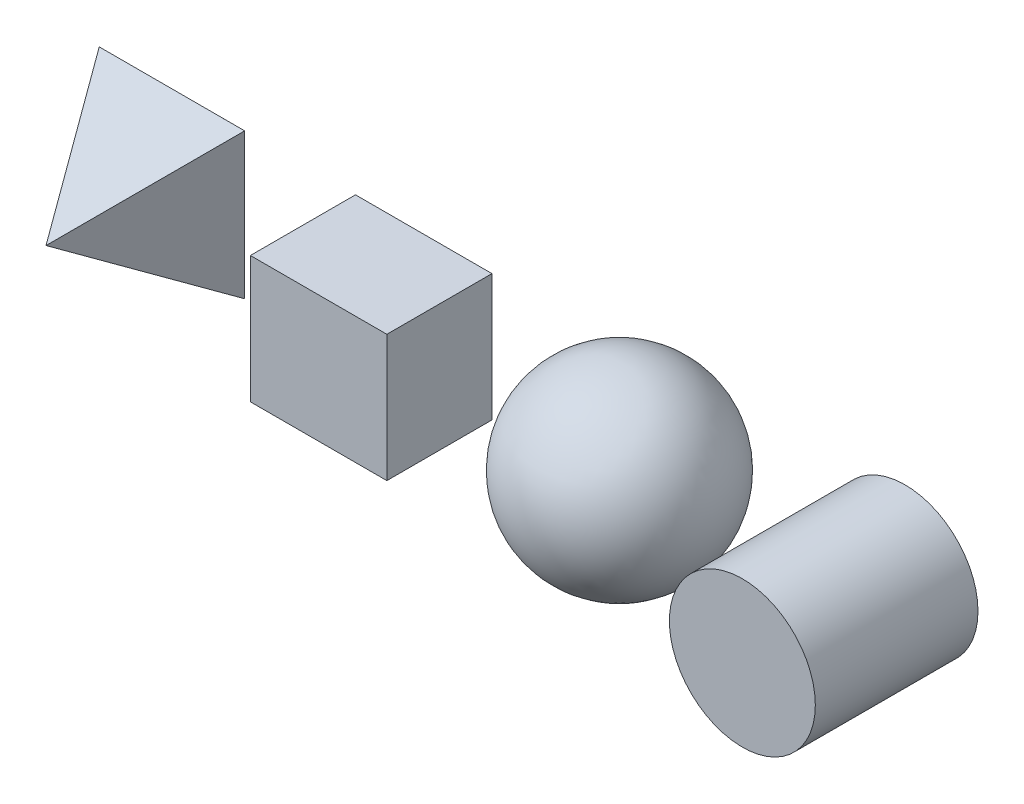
SolidWorks part; units mm, degrees
ref_plane "Front XY" through (0, 0, 0) normal (0, 0, 1) x (1, 0, 0)
ref_plane "Top XZ" through (0, 0, 0) normal (0, 1, 0) x (1, 0, 0)
ref_plane "Right YZ" through (0, 0, 0) normal (1, 0, 0) x (0, 0, -1)
sketch "Sketch1" plane through (0, 0, 0) normal (0, 0, 1) x (1, 0, 0)
  line L1 (0, 0) -> (24.0771, 0)
  line L2 (0, 0) -> (0, -22.364)
  line L3 (0, -22.364) -> (24.0771, -22.364)
  line L4 (24.0771, 0) -> (24.0771, -22.364)
extrude "Extrude1" add sketch "Sketch1" along normal blind 18.542
sketch "Sketch2" plane through (0, 0, 0) normal (0, 0, 1) x (1, 0, 0)
  line L0 (56.3261, 7.5353) -> (56.3261, -25.6979)
  arc A0 (56.3261, 7.5353) -> (56.3261, -25.6979) centre (56.3261, -9.0813) ccw
revolve "Revolve1" add sketch "Sketch2" angle 360 about L0
sketch "Sketch3" plane through (0, 0, 0) normal (0, 0, 1) x (1, 0, 0)
  line L1 (-19.5517, 0) -> (-45.212, 0)
  line L2 (-19.5517, 0) -> (-19.5517, -25.6604)
  line L3 (-19.5517, -25.6604) -> (-45.212, -25.6604)
  line L4 (-45.212, 0) -> (-45.212, -25.6604)
extrude "Extrude2" add sketch "Sketch3" along normal blind 28.702 draft 30
sketch "Sketch4" plane through (0, 0, 0) normal (0, 0, 1) x (1, 0, 0)
  circle A0 centre (96.9569, -8.6978) radius 12.8747
extrude "Extrude3" add sketch "Sketch4" along normal blind 28.702
move or copy body "Body-Move/Copy1" bodies to move or copy 102 copy no translate (0, 0, 9.7575)
